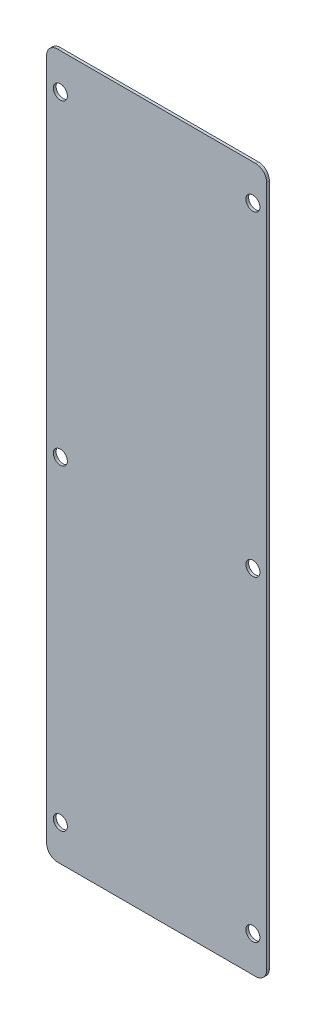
SolidWorks part; units mm, degrees
ref_plane "Front Plane" through (0, 0, 0) normal (0, 0, 1) x (1, 0, 0)
ref_plane "Top Plane" through (0, 0, 0) normal (0, 1, 0) x (1, 0, 0)
ref_plane "Right Plane" through (0, 0, 0) normal (1, 0, 0) x (0, 0, -1)
sketch "Sketch1" plane through (0, 0, 0) normal (0, 0, 1) x (1, 0, 0)
  line L1 (-40, -128) -> (40, -128)
  line L2 (-40, -128) -> (-40, 128)
  line L3 (-40, 128) -> (40, 128)
  line L4 (40, -128) -> (40, 128)
  line L5 (-40, -128) -> (40, 128) construction
  line L6 (-40, 128) -> (40, -128) construction
  point P0 (0, 0)
extrude "Boss-Extrude1" add sketch "Sketch1" along normal blind 1
fillet "Fillet1" radius 4 4 edges at (-40, 128, 0.5) (-40, -128, 0.5) (40, -128, 0.5) (40, 128, 0.5)
sketch "Sketch2" plane through (0, 0, 1) normal (0, 0, 1) x (1, 0, 0)
  circle A0 centre (35, -115) radius 2.55
  circle A2 centre (-35, -115) radius 2.55
  circle A3 centre (-35, 0) radius 2.55
  circle A4 centre (35, 0) radius 2.55
  circle A5 centre (35, 115) radius 2.55
  circle A6 centre (-35, 115) radius 2.55
  dimension "D1" = 5.1
extrude "Cut-Extrude1" cut sketch "Sketch2" against normal through all
equation "\"Base-Width\"= 420"
equation "\"Base-Height\"= 320"
equation "\"Support-Rod-Diameter\"= 16"
equation "\"Support-Rod-X-Offset\"= 35"
equation "\"Support-Rod-Y-Offset\"= 35"
equation "\"Base-Thickness\"= 5"
equation "\"Base-Depth\"= 82"
equation "\"Corner-Radius-Major\"= \"Support-Rod-Diameter\""
equation "\"Cutout-Horizontal\"= \"Base-Width\" * 0.8"
equation "\"Cutout-Vertical\"= \"Base-Height\" * 0.6"
equation "\"Outer-Support-Bore-Diameter\"= 6.1"
equation "\"Inner-Support-Bore-Diameter\"= 8.2"
equation "\"Cutout-Depth\"= 20"
equation "\"D1@Sketch1\"=\"Base-Depth\" - 2"
equation "\"D2@Sketch1\"= \"Base-Height\" - ( \"Support-Rod-Diameter\" * 4 )"
equation "\"D2@Sketch1\"=\"Base-Width\""
equation "\"D1@Sketch7\"=\"Cutout-Vertical\""
equation "\"D2@Sketch6\"=\"Cutout-Horizontal\""
equation "\"D2@Sketch8\"= \"Base-Width\" - ( \"Support-Rod-X-Offset\" ) + 5"
equation "\"D1@Sketch8\" = \"Base-Height\" - \"Support-Rod-Y-Offset\" + 10"
equation "\"D1@Major-Fillet\" = \"Corner-Radius-Major\""
equation "\"D1@Sketch1\"=\"Base-Height\""
